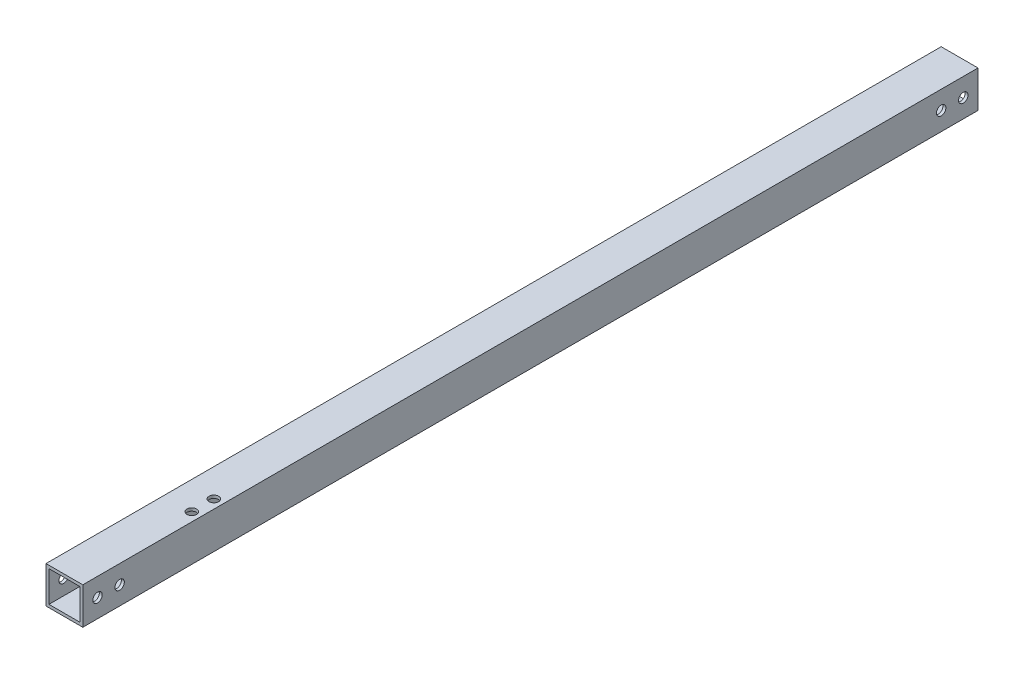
SolidWorks part; units mm, degrees
ref_plane "Front Plane" through (0, 0, 0) normal (0, 0, 1) x (1, 0, 0)
ref_plane "Top Plane" through (0, 0, 0) normal (0, 1, 0) x (1, 0, 0)
ref_plane "Right Plane" through (0, 0, 0) normal (1, 0, 0) x (0, 0, -1)
sketch "Esquisse1" plane through (0, 0, 0) normal (0, 0, 1) x (1, 0, 0)
  line L0 (-10.5, 10.5) -> (10.5, 10.5)
  line L1 (-12.5, 12.5) -> (12.5, 12.5)
  line L2 (-12.5, 12.5) -> (-12.5, -12.5)
  line L3 (-12.5, -12.5) -> (12.5, -12.5)
  line L4 (12.5, 12.5) -> (12.5, -12.5)
  line L5 (-12.5, 12.5) -> (12.5, -12.5) construction
  line L6 (-12.5, -12.5) -> (12.5, 12.5) construction
  line L7 (10.5, 10.5) -> (10.5, -10.5)
  line L8 (-10.5, -10.5) -> (10.5, -10.5)
  line L9 (-10.5, 10.5) -> (-10.5, -10.5)
  point P0 (0, 0)
  dimension "D1" = 25
  dimension "D2" = 25
  dimension "D3" = 2
extrude "Boss.-Extru.1" add sketch "Esquisse1" against normal blind 608
sketch "Esquisse2" plane through (-12.5, 0, 0) normal (-1, 0, 0) x (0, 0, 1)
  line L0 (-608, 0) -> (0, 0) construction
  line L1 (-608, 12.5) -> (-608, -12.5) construction
  line L2 (-10, 0) -> (-10, -12.7904) construction
  line L3 (-25, 0) -> (-25, 8.5674) construction
  line L4 (0, -12.5) -> (0, 12.5) construction
  circle A0 centre (-598, 0) radius 3.2
  circle A1 centre (-583, 0) radius 3.2
  circle A2 centre (-10, 0) radius 3.2
  circle A3 centre (-25, 0) radius 3.2
  point P13 (-25, 4.2837)
  dimension "D2" = 6.4
  dimension "D3" = 6.4
  dimension "D4" = 15
  dimension "D5" = 6.4
  dimension "D6" = 6.4
  dimension "D1" = 10
  dimension "D7" = 15
  dimension "D8" = 10
extrude "Enlèv. mat.-Extru.1" cut sketch "Esquisse2" against normal through all
sketch "Esquisse3" plane through (0, -12.5, 0) normal (0, -1, 0) x (1, 0, 0)
  line L0 (0, 0) -> (0, -148.5255) construction
  line L1 (-12.5, 0) -> (12.5, 0) construction
  line L2 (12.5, -608) -> (12.5, 0) construction
  line L3 (6.5, -95) -> (6.5, -80) construction
  line L4 (0, -97) -> (18.4494, -97) construction
  circle A3 centre (6.5, -95) radius 3.25
  circle A4 centre (6.5, -80) radius 3.25
  dimension "D5" = 80
  dimension "D6" = 6.5
  dimension "D7" = 6.5
  dimension "D8" = 6
  dimension "D9" = 15
  dimension "D10" = 2
extrude "Enlèv. mat.-Extru.2" cut sketch "Esquisse3" against normal blind 30
